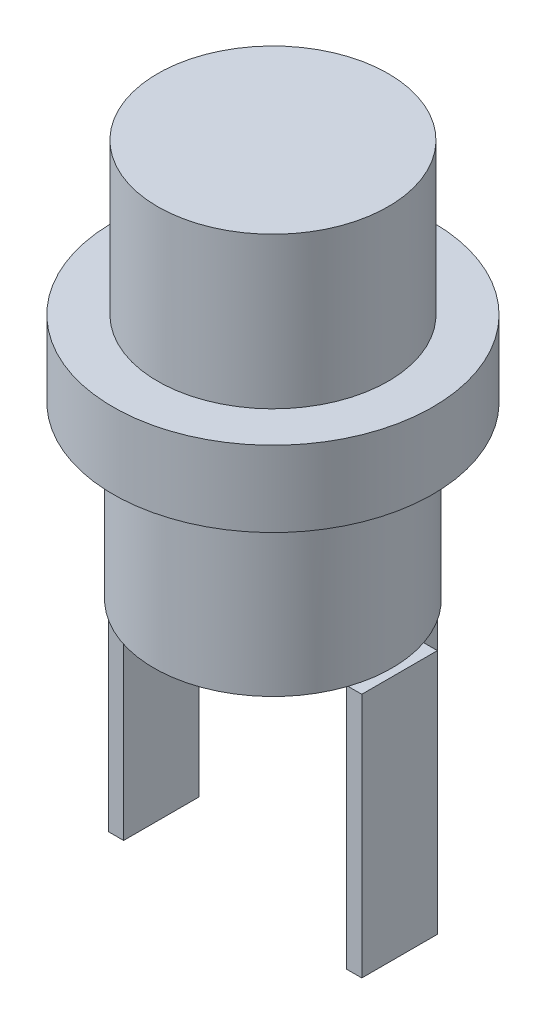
SolidWorks part; units mm, degrees
ref_plane "Front Plane" through (0, 0, 0) normal (0, 0, 1) x (1, 0, 0)
ref_plane "Top Plane" through (0, 0, 0) normal (0, 1, 0) x (1, 0, 0)
ref_plane "Right Plane" through (0, 0, 0) normal (1, 0, 0) x (0, 0, -1)
sketch "Sketch1" plane through (0, 0, 0) normal (0, 1, 0) x (1, 0, 0)
  circle A0 centre (0, 0) radius 3.8735
  dimension "D1" = 7.747
extrude "Boss-Extrude1" add sketch "Sketch1" along normal blind 5.08
sketch "Sketch2" plane through (0, 0, 0) normal (0, -1, 0) x (1, 0, 0)
  circle A0 centre (0, 0) radius 5.3721
  dimension "D1" = 10.7442
extrude "Boss-Extrude2" add sketch "Sketch2" along normal blind 2.54
sketch "Sketch3" plane through (0, -2.54, 0) normal (0, -1, 0) x (1, 0, 0)
  circle A0 centre (0, 0) radius 4.0005
  dimension "D1" = 8.001
extrude "Boss-Extrude3" add sketch "Sketch3" along normal blind 5.7404
sketch "Sketch4" plane through (0, -8.2804, 0) normal (0, -1, 0) x (1, 0, 0)
  line L0 (0, 0) -> (0, 4.0005) construction
  line L1 (-3.7465, -1.27) -> (-4.2545, -1.27)
  line L2 (-3.7465, -1.27) -> (-3.7465, 1.27)
  line L3 (-3.7465, 1.27) -> (-4.2545, 1.27)
  line L4 (-4.2545, -1.27) -> (-4.2545, 1.27)
  line L5 (-3.7465, -1.27) -> (-4.2545, 1.27) construction
  line L6 (-3.7465, 1.27) -> (-4.2545, -1.27) construction
  line L7 (1.27, -4.2545) -> (-1.27, -4.2545)
  line L8 (1.27, -4.2545) -> (1.27, -3.7465)
  line L9 (1.27, -3.7465) -> (-1.27, -3.7465)
  line L10 (-1.27, -4.2545) -> (-1.27, -3.7465)
  line L11 (1.27, -4.2545) -> (-1.27, -3.7465) construction
  line L12 (1.27, -3.7465) -> (-1.27, -4.2545) construction
  line L13 (3.7465, 1.27) -> (4.2545, -1.27) construction
  line L14 (3.7465, -1.27) -> (4.2545, 1.27) construction
  line L15 (4.2545, -1.27) -> (4.2545, 1.27)
  line L16 (3.7465, 1.27) -> (4.2545, 1.27)
  line L17 (3.7465, -1.27) -> (3.7465, 1.27)
  line L18 (3.7465, -1.27) -> (4.2545, -1.27)
  circle A0 centre (0, 0) radius 4.0005 construction
  circle A1 centre (0, 0) radius 4.0005 construction
  point P0 (-4.0005, 0)
  point P9 (0, -4.0005)
  point P22 (4.0005, 0)
  dimension "D1" = 2.54
  dimension "D2" = 0.508
extrude "Boss-Extrude4" add sketch "Sketch4" along normal blind 8.255
